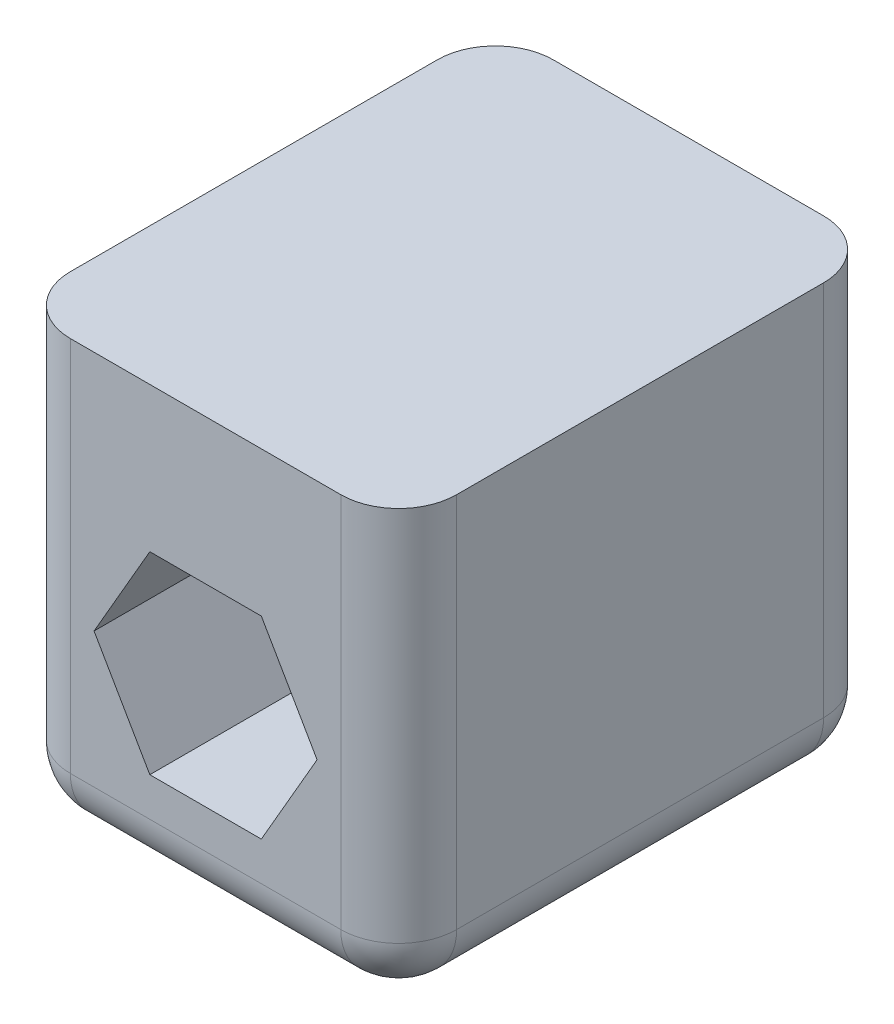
SolidWorks part; units mm, degrees
ref_plane "Front Plane" through (0, 0, 0) normal (0, 0, 1) x (1, 0, 0)
ref_plane "Top Plane" through (0, 0, 0) normal (0, 1, 0) x (1, 0, 0)
ref_plane "Right Plane" through (0, 0, 0) normal (1, 0, 0) x (0, 0, -1)
sketch "Sketch1" plane through (0, 0, 0) normal (0, 0, 1) x (1, 0, 0)
  line L0 (0, 0) -> (0, 12.5) construction
  line L1 (-10, -10) -> (10, -10)
  line L2 (-10, -10) -> (-10, 12.5)
  line L3 (-10, 12.5) -> (10, 12.5)
  line L4 (10, -10) -> (10, 12.5)
  line L5 (0, 0) -> (-10, 0) construction
  line L6 (0, 0) -> (10, 0) construction
  circle A0 centre (0, 0) radius 3.2
  dimension "D1" = 6.4
  dimension "D2" = 12.5
  dimension "D3" = 10
  dimension "D4" = 20
  dimension "D5" = 10
  dimension "D6" = 12.5
extrude "Boss-Extrude1" add sketch "Sketch1" along normal blind 25
sketch "Sketch2" plane through (0, 0, 25) normal (0, 0, 1) x (1, 0, 0)
  line L0 (-5.7735, 0) -> (0, 0) construction
  line L1 (5.7735, 0) -> (2.8868, 5)
  line L2 (2.8868, 5) -> (-2.8868, 5)
  line L3 (-2.8868, 5) -> (-5.7735, 0)
  line L4 (-5.7735, 0) -> (-2.8868, -5)
  line L5 (-2.8868, -5) -> (2.8868, -5)
  line L6 (2.8868, -5) -> (5.7735, 0)
  circle A0 centre (0, 0) radius 5 construction
  dimension "D1" = 10
extrude "Cut-Extrude1" cut sketch "Sketch2" against normal blind 10
fillet "Fillet2" radius 3 8 edges at (-10, 1.25, 0) (10, 1.25, 0) (0, -10, 0) (-10, 1.25, 25) (10, 1.25, 25) (0, -10, 25) (10, -10, 12.5) (-10, -10, 12.5)
